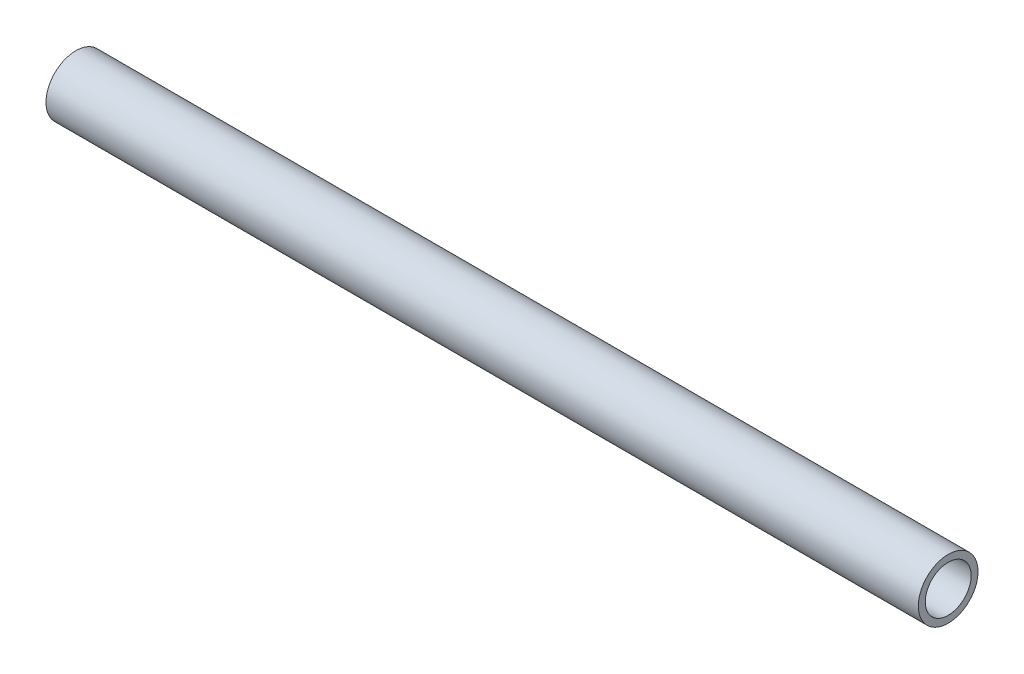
SolidWorks part; units mm, degrees
ref_plane "Front" through (0, 0, 0) normal (0, 0, 1) x (1, 0, 0)
ref_plane "Top" through (0, 0, 0) normal (0, 1, 0) x (1, 0, 0)
ref_plane "Right" through (0, 0, 0) normal (1, 0, 0) x (0, 0, -1)
sketch "Sketch1" plane through (0, 0, 0) normal (0, 0, 1) x (1, 0, 0)
  line L0 (0, 0) -> (482.6, 0)
  line L1 (9.9848, 0) -> (-9.9848, 0) construction
  dimension "D1" = 482.6
other "Structural Member1"
ref_plane "Plane1" through (0, 0, 0) normal (1, 0, 0) x (0, 0, -1)
sketch "Sketch11" plane through (0, 0, 0) normal (1, 0, 0) x (0, 0, -1)
  circle A0 centre (0, 0) radius 12.7
  circle A1 centre (0, 0) radius 16.51
  point P3 (0, 0)
  dimension "D1" = 33.02
  dimension "D2" = 25.4
